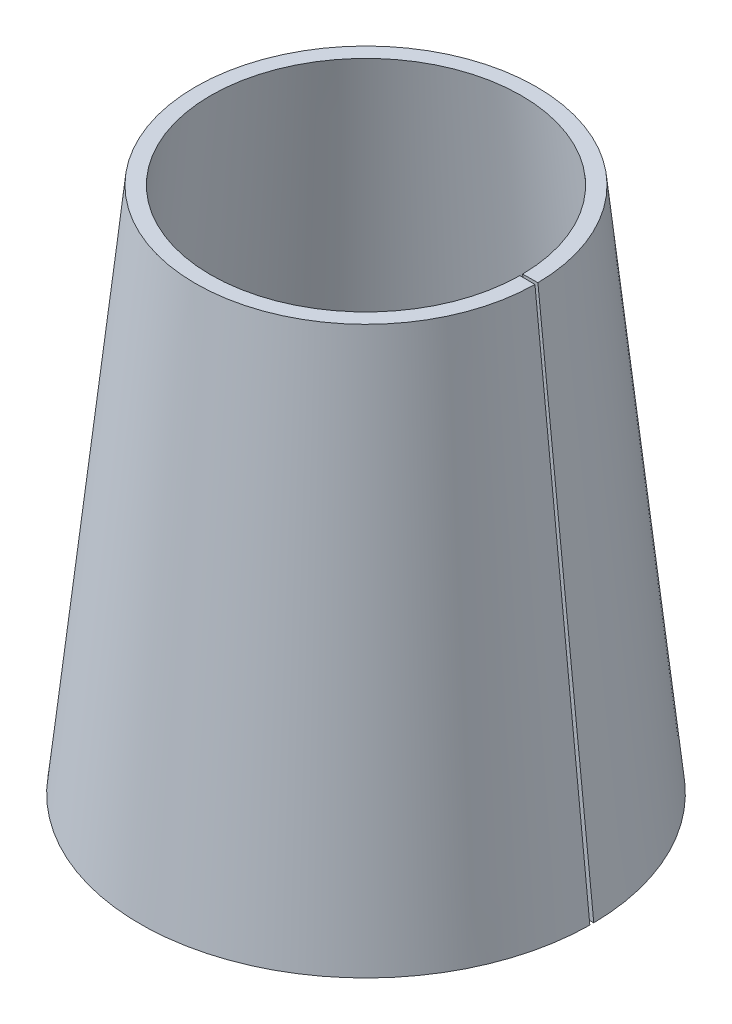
SolidWorks part; units mm, degrees
ref_plane "Front Plane" through (0, 0, 0) normal (0, 0, 1) x (1, 0, 0)
ref_plane "Top Plane" through (0, 0, 0) normal (0, 1, 0) x (1, 0, 0)
ref_plane "Right Plane" through (0, 0, 0) normal (1, 0, 0) x (0, 0, -1)
sketch "Sketch1" plane through (0, 0, 0) normal (0, 1, 0) x (1, 0, 0)
  circle A0 centre (0, 0) radius 30
  dimension "D1" = 60
extrude "Boss-Extrude1" add sketch "Sketch1" along normal blind 70 draft 6 contours A0
shell "Shell1" thickness 2
sketch "Sketch2" plane through (0, 0, 0) normal (0, 1, 0) x (1, 0, 0)
  line L0 (0, 0) -> (30, 0) construction
  line L1 (0, 0) -> (29.9989, 0.2618)
  line L2 (0, 0) -> (29.9989, -0.2618)
  circle A0 centre (0, 0) radius 30 construction
  circle A2 centre (0, 0) radius 30
  arc A3 (29.9989, -0.2618) -> (29.9989, 0.2618) centre (0, 0) ccw
  dimension "D1" = 1
  dimension "D2" = 0
extrude "Cut-Extrude1" cut sketch "Sketch2" along normal through all
